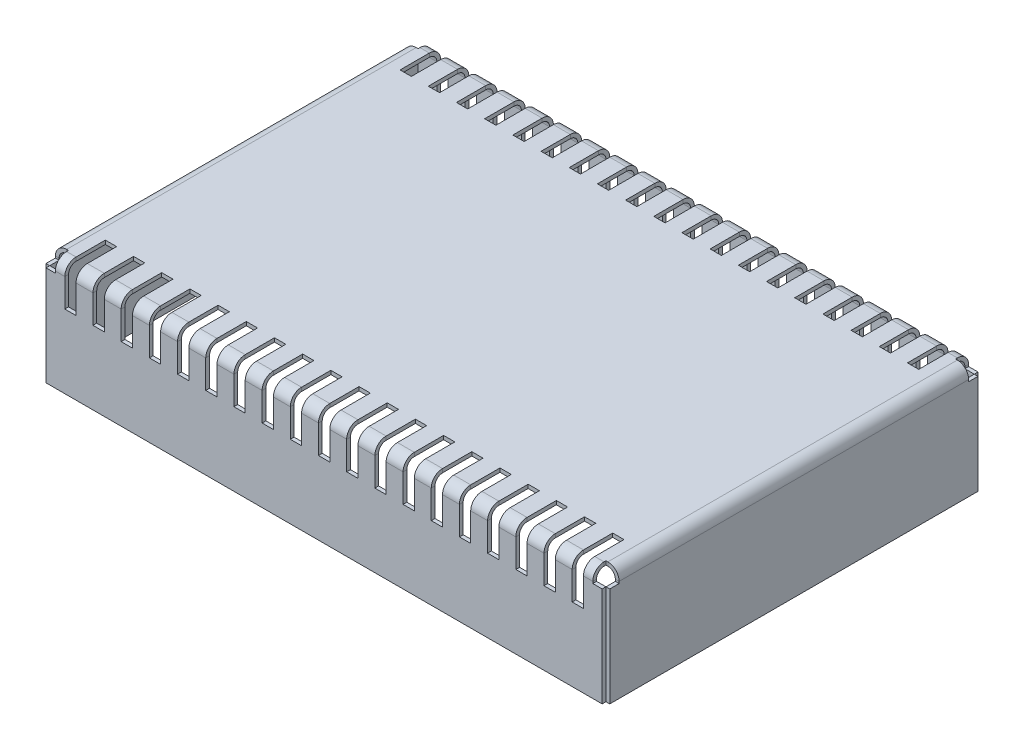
SolidWorks part; units mm, degrees
ref_plane "Front" through (0, 0, 0) normal (0, 0, 1) x (1, 0, 0)
ref_plane "Top" through (0, 0, 0) normal (0, 1, 0) x (1, 0, 0)
ref_plane "Right" through (0, 0, 0) normal (1, 0, 0) x (0, 0, -1)
sketch "Sketch1" plane through (0, 0, 0) normal (0, 1, 0) x (1, 0, 0)
  line L0 (75, -50) -> (-75, 50) construction
  line L1 (-75, 50) -> (75, 50)
  line L2 (-75, 50) -> (-75, -50)
  line L3 (-75, -50) -> (75, -50)
  line L4 (75, 50) -> (75, -50)
  dimension "D1" = 150
  dimension "D2" = 100
extrude "Extrude1" add sketch "Sketch1" against normal blind 30
shell "Shell1" thickness 1
rip "Rip1"
sheet metal parameters "Sheet-Metal1" parameters "D1"=2
bend "SharpBend4" bend angle 90 parameters "D1"=0, "D5"=1
flatten bends "Flatten-Bends1" parameters "D1"=0
sketch "Sharp-Sketch1" plane through (0, -1, 0) normal (0, -1, 0) x (1, 0, 0)
  line L0 (-71.5, -49.3562) -> (71.5, -49.3562) construction
  line L1 (74.3562, -46.5) -> (74.3562, 46.5) construction
  line L2 (71.5, 49.3562) -> (-71.5, 49.3562) construction
  line L3 (-74.3562, 46.5) -> (-74.3562, -46.5) construction
bend "SharpBend1" bend angle 90 parameters "D1"=0, "D5"=4
bend "SharpBend2" bend angle 90 parameters "D1"=0, "D5"=3
bend "SharpBend3" bend angle 90 parameters "D1"=0, "D5"=2
sketch "Sketch4" plane through (0, -1, 0) normal (0, -1, 0) x (1, 0, 0)
  line L0 (-73.99, 52.2124) -> (-73.99, 78.7124) construction
  line L1 (-68.99, 39.2124) -> (-65.99, 39.2124)
  line L2 (-68.99, 39.2124) -> (-68.99, 59.2124)
  line L3 (-68.99, 59.2124) -> (-65.99, 59.2124)
  line L4 (-65.99, 39.2124) -> (-65.99, 59.2124)
  line L5 (-73.99, 78.7124) -> (73.99, 78.7124) construction
  line L6 (-61.49, 39.2124) -> (-58.49, 39.2124)
  line L7 (-61.49, 39.2124) -> (-61.49, 59.2124)
  line L8 (-61.49, 59.2124) -> (-58.49, 59.2124)
  line L9 (-58.49, 39.2124) -> (-58.49, 59.2124)
  line L10 (-53.99, 39.2124) -> (-50.99, 39.2124)
  line L11 (-53.99, 39.2124) -> (-53.99, 59.2124)
  line L12 (-53.99, 59.2124) -> (-50.99, 59.2124)
  line L13 (-50.99, 39.2124) -> (-50.99, 59.2124)
  line L14 (-46.49, 39.2124) -> (-43.49, 39.2124)
  line L15 (-46.49, 39.2124) -> (-46.49, 59.2124)
  line L16 (-46.49, 59.2124) -> (-43.49, 59.2124)
  line L17 (-43.49, 39.2124) -> (-43.49, 59.2124)
  line L18 (-38.99, 39.2124) -> (-35.99, 39.2124)
  line L19 (-38.99, 39.2124) -> (-38.99, 59.2124)
  line L20 (-38.99, 59.2124) -> (-35.99, 59.2124)
  line L21 (-35.99, 39.2124) -> (-35.99, 59.2124)
  line L22 (-31.49, 39.2124) -> (-28.49, 39.2124)
  line L23 (-31.49, 39.2124) -> (-31.49, 59.2124)
  line L24 (-31.49, 59.2124) -> (-28.49, 59.2124)
  line L25 (-28.49, 39.2124) -> (-28.49, 59.2124)
  line L26 (-23.99, 39.2124) -> (-20.99, 39.2124)
  line L27 (-23.99, 39.2124) -> (-23.99, 59.2124)
  line L28 (-23.99, 59.2124) -> (-20.99, 59.2124)
  line L29 (-20.99, 39.2124) -> (-20.99, 59.2124)
  line L30 (-16.49, 39.2124) -> (-13.49, 39.2124)
  line L31 (-16.49, 39.2124) -> (-16.49, 59.2124)
  line L32 (-16.49, 59.2124) -> (-13.49, 59.2124)
  line L33 (-13.49, 39.2124) -> (-13.49, 59.2124)
  line L34 (-8.99, 39.2124) -> (-5.99, 39.2124)
  line L35 (-8.99, 39.2124) -> (-8.99, 59.2124)
  line L36 (-8.99, 59.2124) -> (-5.99, 59.2124)
  line L37 (-5.99, 39.2124) -> (-5.99, 59.2124)
  line L38 (-1.49, 39.2124) -> (1.51, 39.2124)
  line L39 (-1.49, 39.2124) -> (-1.49, 59.2124)
  line L40 (-1.49, 59.2124) -> (1.51, 59.2124)
  line L41 (1.51, 39.2124) -> (1.51, 59.2124)
  line L42 (6.01, 39.2124) -> (9.01, 39.2124)
  line L43 (6.01, 39.2124) -> (6.01, 59.2124)
  line L44 (6.01, 59.2124) -> (9.01, 59.2124)
  line L45 (9.01, 39.2124) -> (9.01, 59.2124)
  line L46 (13.51, 39.2124) -> (16.51, 39.2124)
  line L47 (13.51, 39.2124) -> (13.51, 59.2124)
  line L48 (13.51, 59.2124) -> (16.51, 59.2124)
  line L49 (16.51, 39.2124) -> (16.51, 59.2124)
  line L50 (21.01, 39.2124) -> (24.01, 39.2124)
  line L51 (21.01, 39.2124) -> (21.01, 59.2124)
  line L52 (21.01, 59.2124) -> (24.01, 59.2124)
  line L53 (24.01, 39.2124) -> (24.01, 59.2124)
  line L54 (28.51, 39.2124) -> (31.51, 39.2124)
  line L55 (28.51, 39.2124) -> (28.51, 59.2124)
  line L56 (28.51, 59.2124) -> (31.51, 59.2124)
  line L57 (31.51, 39.2124) -> (31.51, 59.2124)
  line L58 (36.01, 39.2124) -> (39.01, 39.2124)
  line L59 (36.01, 39.2124) -> (36.01, 59.2124)
  line L60 (36.01, 59.2124) -> (39.01, 59.2124)
  line L61 (39.01, 39.2124) -> (39.01, 59.2124)
  line L62 (43.51, 39.2124) -> (46.51, 39.2124)
  line L63 (43.51, 39.2124) -> (43.51, 59.2124)
  line L64 (43.51, 59.2124) -> (46.51, 59.2124)
  line L65 (46.51, 39.2124) -> (46.51, 59.2124)
  line L66 (51.01, 39.2124) -> (54.01, 39.2124)
  line L67 (51.01, 39.2124) -> (51.01, 59.2124)
  line L68 (51.01, 59.2124) -> (54.01, 59.2124)
  line L69 (54.01, 39.2124) -> (54.01, 59.2124)
  line L70 (58.51, 39.2124) -> (61.51, 39.2124)
  line L71 (58.51, 39.2124) -> (58.51, 59.2124)
  line L72 (58.51, 59.2124) -> (61.51, 59.2124)
  line L73 (61.51, 39.2124) -> (61.51, 59.2124)
  line L74 (66.01, 39.2124) -> (69.01, 39.2124)
  line L75 (66.01, 39.2124) -> (66.01, 59.2124)
  line L76 (66.01, 59.2124) -> (69.01, 59.2124)
  line L77 (69.01, 39.2124) -> (69.01, 59.2124)
  line L78 (-116.6099, 0) -> (119.8752, 0) construction
  line L79 (69.01, -39.2124) -> (69.01, -59.2124)
  line L80 (66.01, -59.2124) -> (69.01, -59.2124)
  line L81 (66.01, -39.2124) -> (66.01, -59.2124)
  line L82 (66.01, -39.2124) -> (69.01, -39.2124)
  line L83 (61.51, -39.2124) -> (61.51, -59.2124)
  line L84 (58.51, -59.2124) -> (61.51, -59.2124)
  line L85 (58.51, -39.2124) -> (58.51, -59.2124)
  line L86 (58.51, -39.2124) -> (61.51, -39.2124)
  line L87 (54.01, -39.2124) -> (54.01, -59.2124)
  line L88 (51.01, -59.2124) -> (54.01, -59.2124)
  line L89 (51.01, -39.2124) -> (51.01, -59.2124)
  line L90 (51.01, -39.2124) -> (54.01, -39.2124)
  line L91 (46.51, -39.2124) -> (46.51, -59.2124)
  line L92 (43.51, -59.2124) -> (46.51, -59.2124)
  line L93 (43.51, -39.2124) -> (43.51, -59.2124)
  line L94 (43.51, -39.2124) -> (46.51, -39.2124)
  line L95 (39.01, -39.2124) -> (39.01, -59.2124)
  line L96 (36.01, -59.2124) -> (39.01, -59.2124)
  line L97 (36.01, -39.2124) -> (36.01, -59.2124)
  line L98 (36.01, -39.2124) -> (39.01, -39.2124)
  line L99 (31.51, -39.2124) -> (31.51, -59.2124)
  line L100 (28.51, -59.2124) -> (31.51, -59.2124)
  line L101 (28.51, -39.2124) -> (28.51, -59.2124)
  line L102 (28.51, -39.2124) -> (31.51, -39.2124)
  line L103 (24.01, -39.2124) -> (24.01, -59.2124)
  line L104 (21.01, -59.2124) -> (24.01, -59.2124)
  line L105 (21.01, -39.2124) -> (21.01, -59.2124)
  line L106 (21.01, -39.2124) -> (24.01, -39.2124)
  line L107 (16.51, -39.2124) -> (16.51, -59.2124)
  line L108 (13.51, -59.2124) -> (16.51, -59.2124)
  line L109 (13.51, -39.2124) -> (13.51, -59.2124)
  line L110 (13.51, -39.2124) -> (16.51, -39.2124)
  line L111 (9.01, -39.2124) -> (9.01, -59.2124)
  line L112 (6.01, -59.2124) -> (9.01, -59.2124)
  line L113 (6.01, -39.2124) -> (6.01, -59.2124)
  line L114 (6.01, -39.2124) -> (9.01, -39.2124)
  line L115 (1.51, -39.2124) -> (1.51, -59.2124)
  line L116 (-1.49, -59.2124) -> (1.51, -59.2124)
  line L117 (-1.49, -39.2124) -> (-1.49, -59.2124)
  line L118 (-1.49, -39.2124) -> (1.51, -39.2124)
  line L119 (-5.99, -39.2124) -> (-5.99, -59.2124)
  line L120 (-8.99, -59.2124) -> (-5.99, -59.2124)
  line L121 (-8.99, -39.2124) -> (-8.99, -59.2124)
  line L122 (-8.99, -39.2124) -> (-5.99, -39.2124)
  line L123 (-13.49, -39.2124) -> (-13.49, -59.2124)
  line L124 (-16.49, -59.2124) -> (-13.49, -59.2124)
  line L125 (-16.49, -39.2124) -> (-16.49, -59.2124)
  line L126 (-16.49, -39.2124) -> (-13.49, -39.2124)
  line L127 (-20.99, -39.2124) -> (-20.99, -59.2124)
  line L128 (-23.99, -59.2124) -> (-20.99, -59.2124)
  line L129 (-23.99, -39.2124) -> (-23.99, -59.2124)
  line L130 (-23.99, -39.2124) -> (-20.99, -39.2124)
  line L131 (-28.49, -39.2124) -> (-28.49, -59.2124)
  line L132 (-31.49, -59.2124) -> (-28.49, -59.2124)
  line L133 (-31.49, -39.2124) -> (-31.49, -59.2124)
  line L134 (-31.49, -39.2124) -> (-28.49, -39.2124)
  line L135 (-35.99, -39.2124) -> (-35.99, -59.2124)
  line L136 (-38.99, -59.2124) -> (-35.99, -59.2124)
  line L137 (-38.99, -39.2124) -> (-38.99, -59.2124)
  line L138 (-38.99, -39.2124) -> (-35.99, -39.2124)
  line L139 (-43.49, -39.2124) -> (-43.49, -59.2124)
  line L140 (-46.49, -59.2124) -> (-43.49, -59.2124)
  line L141 (-46.49, -39.2124) -> (-46.49, -59.2124)
  line L142 (-46.49, -39.2124) -> (-43.49, -39.2124)
  line L143 (-50.99, -39.2124) -> (-50.99, -59.2124)
  line L144 (-53.99, -59.2124) -> (-50.99, -59.2124)
  line L145 (-53.99, -39.2124) -> (-53.99, -59.2124)
  line L146 (-53.99, -39.2124) -> (-50.99, -39.2124)
  line L147 (-58.49, -39.2124) -> (-58.49, -59.2124)
  line L148 (-61.49, -59.2124) -> (-58.49, -59.2124)
  line L149 (-61.49, -39.2124) -> (-61.49, -59.2124)
  line L150 (-61.49, -39.2124) -> (-58.49, -39.2124)
  line L151 (-65.99, -39.2124) -> (-65.99, -59.2124)
  line L152 (-68.99, -59.2124) -> (-65.99, -59.2124)
  line L153 (-68.99, -39.2124) -> (-68.99, -59.2124)
  line L154 (-68.99, -39.2124) -> (-65.99, -39.2124)
  dimension "D1" = 5
  dimension "D2" = 3
  dimension "D3" = 20
  dimension "D4" = 19.5
  dimension "D5" = 4.5
extrude "Cut-Extrude1" cut sketch "Sketch4" against normal through all
process bends "Process-Bends1" parameters "D1"=0
sketch "Flat-Sketch1" plane through (0, -1, 0) normal (0, -1, 0) x (1, 0, 0)
